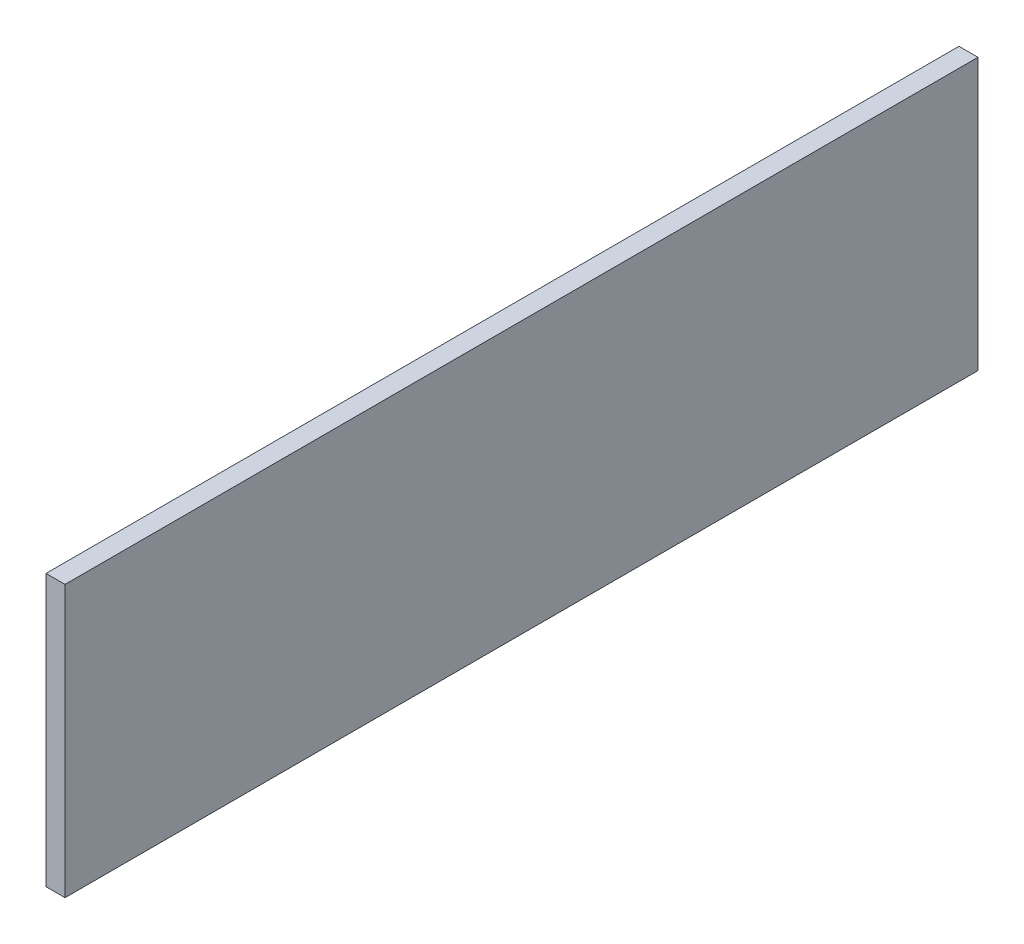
SolidWorks part; units mm, degrees
ref_plane "Front Plane" through (0, 0, 0) normal (0, 0, 1) x (1, 0, 0)
ref_plane "Top Plane" through (0, 0, 0) normal (0, 1, 0) x (1, 0, 0)
ref_plane "Right Plane" through (0, 0, 0) normal (1, 0, 0) x (0, 0, -1)
ref_plane "Front Plane-Bucket_Floor" through (0, 0, 0) normal (0, 0, 1) x (1, 0, 0)
ref_plane "Top Plane-Bucket_Floor" through (0, 0, 0) normal (0, 1, 0) x (1, 0, 0)
ref_plane "Right Plane-Bucket_Floor" through (0, 0, 0) normal (1, 0, 0) x (0, 0, -1)
sketch "Sketch1-Bucket_Floor" plane through (0, 0, 0) normal (0, 0, 1) x (1, 0, 0)
  line L0 (-50.546, 21.0608) -> (-72.8591, 67.8392)
  line L1 (50.546, -21.0608) -> (-50.546, -21.0608)
  line L2 (50.546, -21.0608) -> (50.546, 21.0608)
  line L4 (-50.546, -21.0608) -> (-50.546, 21.0608)
  line L5 (50.546, -21.0608) -> (-50.546, 21.0608) construction
  line L6 (50.546, 21.0608) -> (-50.546, -21.0608) construction
  line L7 (-72.8591, 67.8392) -> (72.8591, 67.8392)
  line L8 (72.8591, 67.8392) -> (50.546, 21.0608)
  point P0 (0, 0)
  dimension "D1" = 101.092
  dimension "D2" = 88.9
  dimension "D3" = 205.501
  dimension "D4" = 42.1217
inserted part "Bucket_Floor"
sketch "Sketch2" plane through (0, 0, 0) normal (0, 0, 1) x (1, 0, 0)
  line L0 (50.546, -21.0608) -> (-50.546, -21.0608) construction
  line L1 (-50.546, 24.2358) -> (-47.371, 24.2358)
  line L2 (-50.546, 24.2358) -> (-50.546, -21.0608)
  line L3 (-50.546, -21.0608) -> (-47.371, -21.0608)
  line L4 (-47.371, 24.2358) -> (-47.371, -21.0608)
  dimension "D1" = 3.175
  dimension "D2" = 3.175
extrude "Boss-Extrude1" add sketch "Sketch2" along normal blind 152.4
